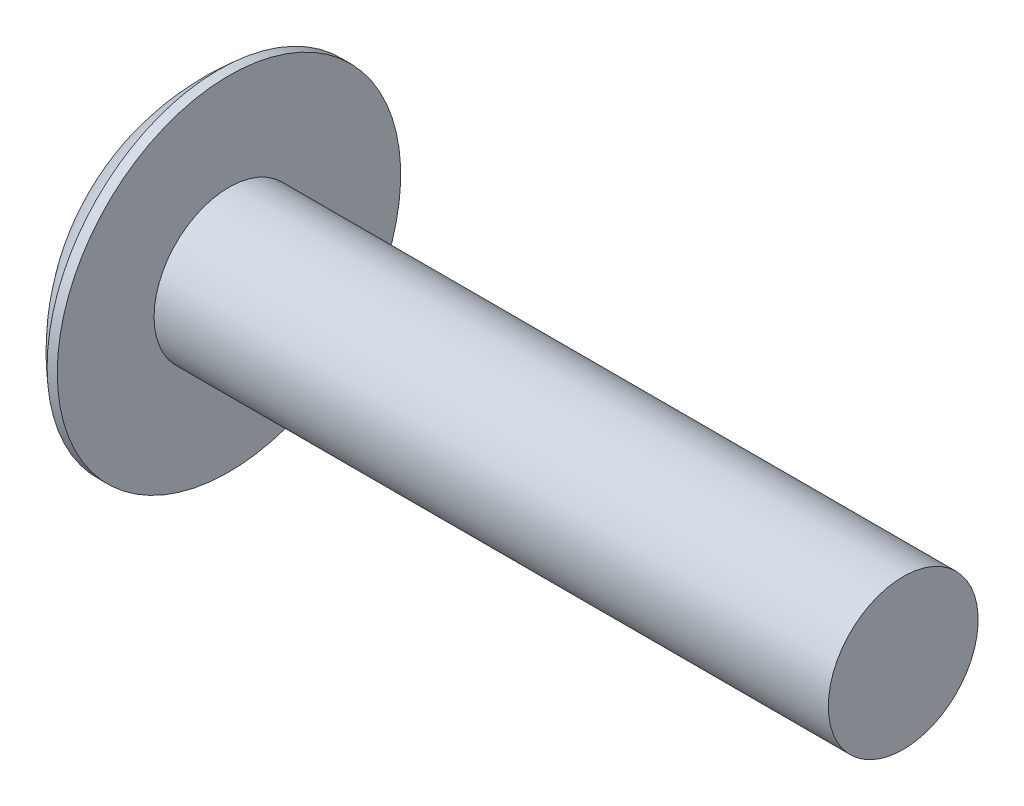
SolidWorks part; units mm, degrees
ref_plane "Plane1" through (0, 0, 0) normal (0, 0, 1) x (1, 0, 0)
ref_plane "Plane2" through (0, 0, 0) normal (0, 1, 0) x (1, 0, 0)
ref_plane "Plane3" through (0, 0, 0) normal (1, 0, 0) x (0, 0, -1)
sketch "BodySke" plane through (0, 0, 0) normal (0, 0, 1) x (1, 0, 0)
  line L0 (3.81, 3.175) -> (3.81, 7.2771)
  line L1 (32.385, 0) -> (0, 0)
  line L2 (-25.4, 0) -> (127, 0) construction
  line L3 (3.3793, -7.2771) -> (3.81, -7.2771) construction
  line L4 (3.81, 3.175) -> (32.385, 3.175)
  line L5 (32.385, 3.175) -> (32.385, 0)
  line L6 (3.3793, 7.2771) -> (3.81, 7.2771)
  line L7 (3.81, -3.175) -> (32.385, -3.175) construction
  line L8 (5.08, 4.7625) -> (5.08, -4.7625) construction
  line L9 (3.81, 6.35) -> (3.81, -3.175) construction
  arc A0 (3.3793, 7.2771) -> (0, 0) centre (9.525, 0) ccw
  dimension "Head_rad" = 9.525
  dimension "Head_ht" = 3.81
  dimension "Diameter" = 6.35
  dimension "Length" = 28.575
  dimension "Head_dia" = 14.5542
  dimension "Advance" = 1.27
  dimension "Thread_nom" = 28.575
revolve "Base-Revolve" add sketch "BodySke" angle 360 about L2
sketch "Sketch2" plane through (0, 0, 0) normal (1, 0, 0) x (0, 0, -1)
  line L0 (7.2771, -0.9525) -> (-7.2771, -0.9525)
  line L1 (7.2771, -0.9525) -> (7.2771, 0.9525)
  line L2 (-7.2771, 0.9525) -> (7.2771, 0.9525)
  line L3 (-7.2771, 0.9525) -> (-7.2771, -0.9525)
  dimension "D1" = 14.5542
  dimension "D2" = 7.2771
  dimension "Slot_width" = 1.905
  dimension "D3" = 0.9525
extrude "Slot" [suppressed] cut sketch "Sketch2" along normal blind 2.2098
sketch "Sketch3" plane through (0, 0, 0) normal (1, 0, 0) x (0, 0, -1)
  line L0 (0.7239, -4.0767) -> (-0.7239, -4.0767)
  line L1 (0.7239, -4.0767) -> (0.7239, 4.0767)
  line L2 (-0.7239, 4.0767) -> (0.7239, 4.0767)
  line L3 (-0.7239, 4.0767) -> (-0.7239, -4.0767)
  dimension "D1" = 0.7239
  dimension "Cross_width" = 1.4478
  dimension "Cross_dia" = 8.1534
  dimension "D2" = 4.0767
ref_plane "Plane4" through (4.6228, 0, 0) normal (1, 0, 0) x (0, 0, -1)
sketch "Sketch4" plane through (4.6228, 0, 0) normal (1, 0, 0) x (0, 0, -1)
  line L0 (0.3619, -0.3619) -> (-0.3619, -0.362)
  line L1 (0.3619, -0.3619) -> (0.3619, 0.3619)
  line L2 (-0.3619, 0.3619) -> (0.3619, 0.3619)
  line L3 (-0.3619, 0.3619) -> (-0.3619, -0.362)
  dimension "D1" = 0.7239
  dimension "D2" = 0.3619
  dimension "D3" = 0.7239
  dimension "D4" = 0.3619
loft "Cross" cut profiles "Sketch3", "Sketch4"
pattern_circular "CirPattern1" count 2 every 90 about axis through (0, 0, 0) along (1, 0, 0) of "Cross"
sketch "ThdSchSke" plane through (0, 0, 0) normal (0, 0, 1) x (1, 0, 0)
  line L0 (5.08, -2.4193) -> (4.5509, -3.175)
  line L1 (5.08, -2.4193) -> (5.6091, -3.175)
  line L2 (5.6091, -3.175) -> (5.6091, -3.9688)
  line L3 (-3.175, 0) -> (5.1513, 0) construction
  line L5 (5.6091, -3.9688) -> (4.5509, -3.9688)
  line L6 (4.5509, -3.9688) -> (4.5509, -3.175)
  dimension "Thread_minor" = 4.8387
  dimension "Diameter" = 6.35
  dimension "Start" = 5.08
  dimension "SideAngle" = 55
  dimension "VeeAngle" = 70
  dimension "Overcut" = 7.9375
revolve "ThreadSchematic" [suppressed] cut sketch "ThdSchSke" angle 360 about L3
pattern_linear "ThdSchPat" [suppressed]
equation "\"D1@Sketch2\" = \"Head_dia@BodySke\""
equation "\"D2@Sketch2\" = \"D1@Sketch2\" / 2"
equation "\"D3@Sketch2\" = \"Slot_width@Sketch2\" / 2"
equation "\"D1@Sketch3\" = \"Cross_width@Sketch3\" / 2"
equation "\"D2@Sketch3\" = \"Cross_dia@Sketch3\" / 2"
equation "\"D1@Sketch4\" = \"Cross_width@Sketch3\" *.5"
equation "\"D2@Sketch4\" = \"D1@Sketch4\" / 2"
equation "\"D3@Sketch4\" = \"D1@Sketch4\""
equation "\"D4@Sketch4\" = \"D3@Sketch4\" / 2"
equation "\"Thread_length@ThreadCosmetic\" = ((sgn( (\"Length@BodySke\" - \"Advance@BodySke\" ) - \"Thread_nom@BodySke\" )-1)*( (\"Length@BodySke\" - \"Advance@BodySke\" ) - \"Thread_nom@BodySke\" ))/-2+ \"Thread_nom@BodySke\""
equation "\"Thread_minor@ThdSchSke\" = \"Thread_minor@ThreadCosmetic\""
equation "\"Diameter@ThdSchSke\" = \"Diameter@BodySke\""
equation "\"Overcut@ThdSchSke\" = \"Diameter@BodySke\" * 1.25"
equation "\"Start@ThdSchSke\" = \"Head_ht@BodySke\" + \"Length@BodySke\" - \"Thread_length@ThreadCosmetic\"  '---Non-countersunk---"
equation "\"Num_threads@ThdSchPat\" = int( \"Thread_length@ThreadCosmetic\" / \"Advance@BodySke\" + 0.999 )  + 1"
equation "\"Advance@ThdSchPat\" = \"Thread_length@ThreadCosmetic\" /  (\"Num_threads@ThdSchPat\" - 1) 'relax it"
